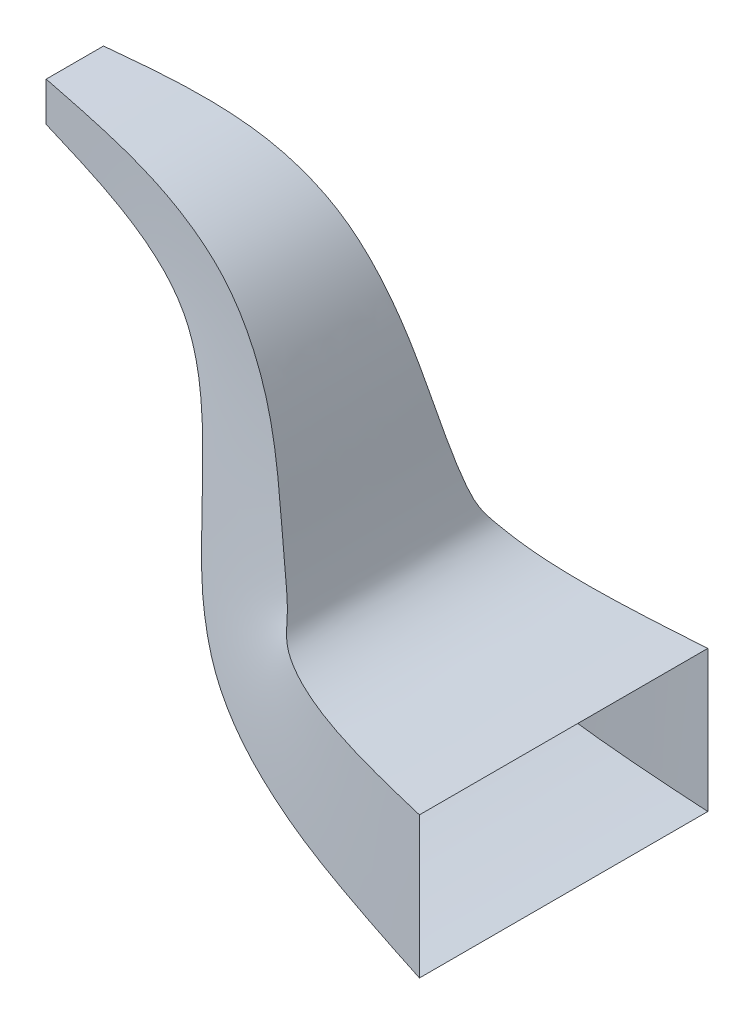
SolidWorks part; units mm, degrees
ref_plane "Front" through (0, 0, 0) normal (0, 0, 1) x (1, 0, 0)
ref_plane "Top" through (0, 0, 0) normal (0, 1, 0) x (1, 0, 0)
ref_plane "Right" through (0, 0, 0) normal (1, 0, 0) x (0, 0, -1)
sketch "Sketch2" plane through (0, 0, 0) normal (0, 0, 1) x (1, 0, 0)
  spline S0 degree 3 poles (0, 0) (20.7688, -4.0968) (69.2554, -13.661) (55.1201, -112.2923) (116.5951, -126.9) (150, -134.8376) knots 0 0 0 0 0.254918 0.595129 1 1 1 1
  dimension "D1" = 150
sketch "Sketch3" plane through (0, 0, 0) normal (1, 0, 0) x (0, 0, -1)
  line L1 (-9.1906, 0) -> (8.448, 0)
  line L2 (-9.1906, 0) -> (-9.1906, 12.0779)
  line L3 (-9.1906, 12.0779) -> (8.448, 12.0779)
  line L4 (8.448, 0) -> (8.448, 12.0779)
ref_plane "Plane1" through (150, 0, 0) normal (1, 0, 0) x (0, 0, -1)
sketch "Sketch4" plane through (150, 0, 0) normal (1, 0, 0) x (0, 0, -1)
  line L1 (-44.3579, -134.8376) -> (44.3579, -134.8376)
  line L2 (-44.3579, -134.8376) -> (-44.3579, -91.3735)
  line L3 (-44.3579, -91.3735) -> (44.3579, -91.3735)
  line L4 (44.3579, -134.8376) -> (44.3579, -91.3735)
surface "Surface-Loft2"
